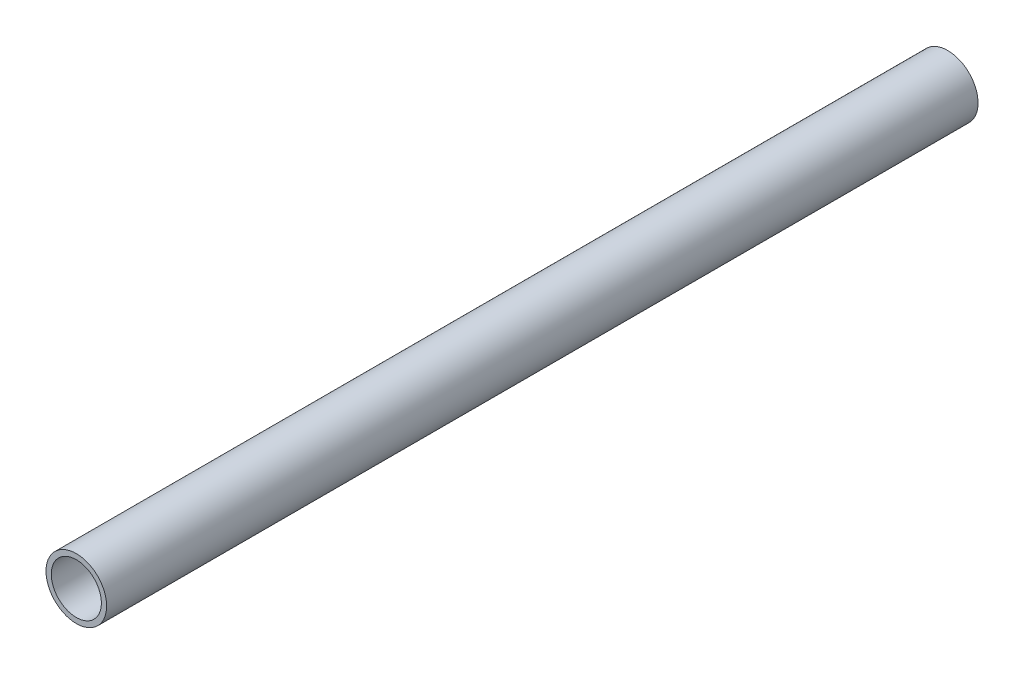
SolidWorks part; units mm, degrees
ref_plane "Plane1" through (0, 0, 0) normal (0, 0, 1) x (1, 0, 0)
ref_plane "Plane2" through (0, 0, 0) normal (0, 1, 0) x (1, 0, 0)
ref_plane "Plane3" through (0, 0, 0) normal (1, 0, 0) x (0, 0, -1)
sketch "Sketch1" plane through (0, 0, 0) normal (0, 0, 1) x (1, 0, 0)
  circle A0 centre (0, 0) radius 17.526
  circle A1 centre (0, 0) radius 21.209
  dimension "D1" = 42.418
  dimension "D2" = 35.052
extrude "Base-Extrude" add sketch "Sketch1" along normal mid plane 609.6
